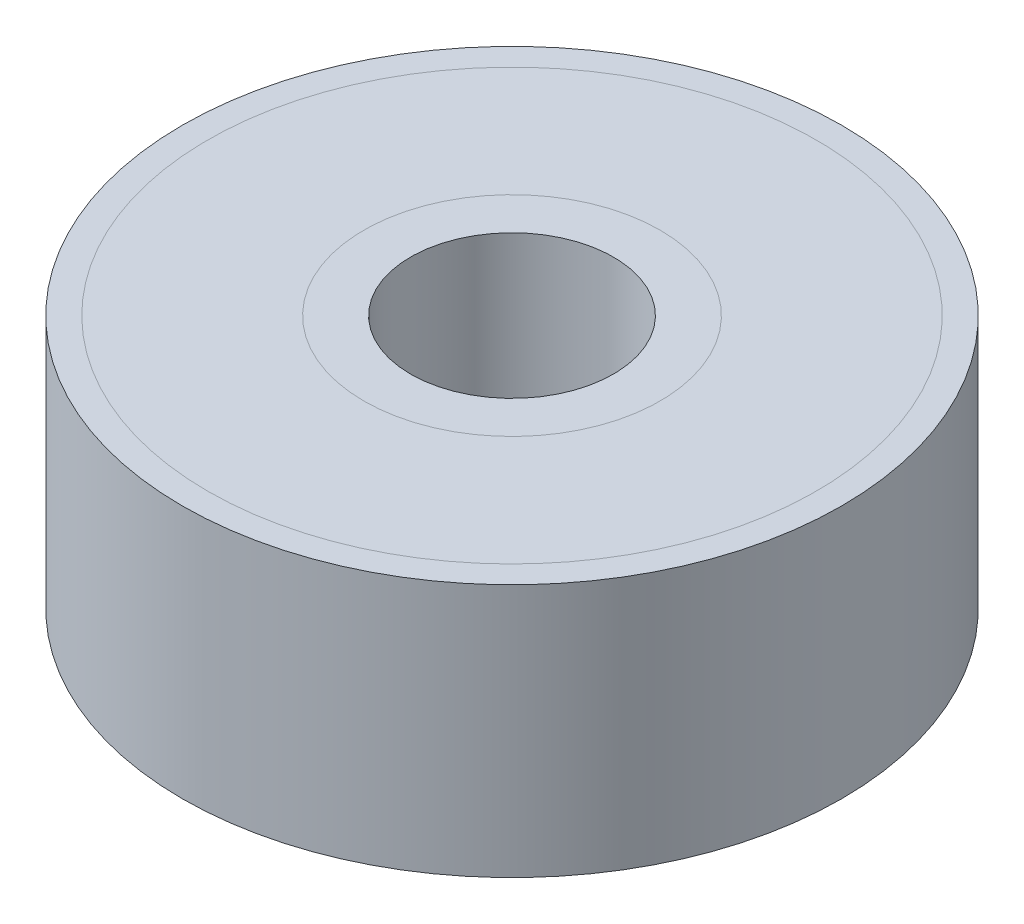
SolidWorks part; units mm, degrees
ref_plane "前视基准面" through (0, 0, 0) normal (0, 0, 1) x (1, 0, 0)
ref_plane "上视基准面" through (0, 0, 0) normal (0, 1, 0) x (1, 0, 0)
ref_plane "右视基准面" through (0, 0, 0) normal (1, 0, 0) x (0, 0, -1)
sketch "草图1" plane through (0, 0, 0) normal (0, 1, 0) x (1, 0, 0)
  circle A0 centre (0, 0) radius 6.5
  circle A1 centre (0, 0) radius 2
extrude "凸台-拉伸1" add sketch "草图1" along normal blind 5
sketch "草图2" plane through (0, 5, 0) normal (0, 1, 0) x (1, 0, 0)
  circle A0 centre (0, 0) radius 2.9193
  circle A1 centre (0, 0) radius 5.9979
split "分割1" trim tools "草图2" bodies to split 106 resulting bodies 107 108 109
